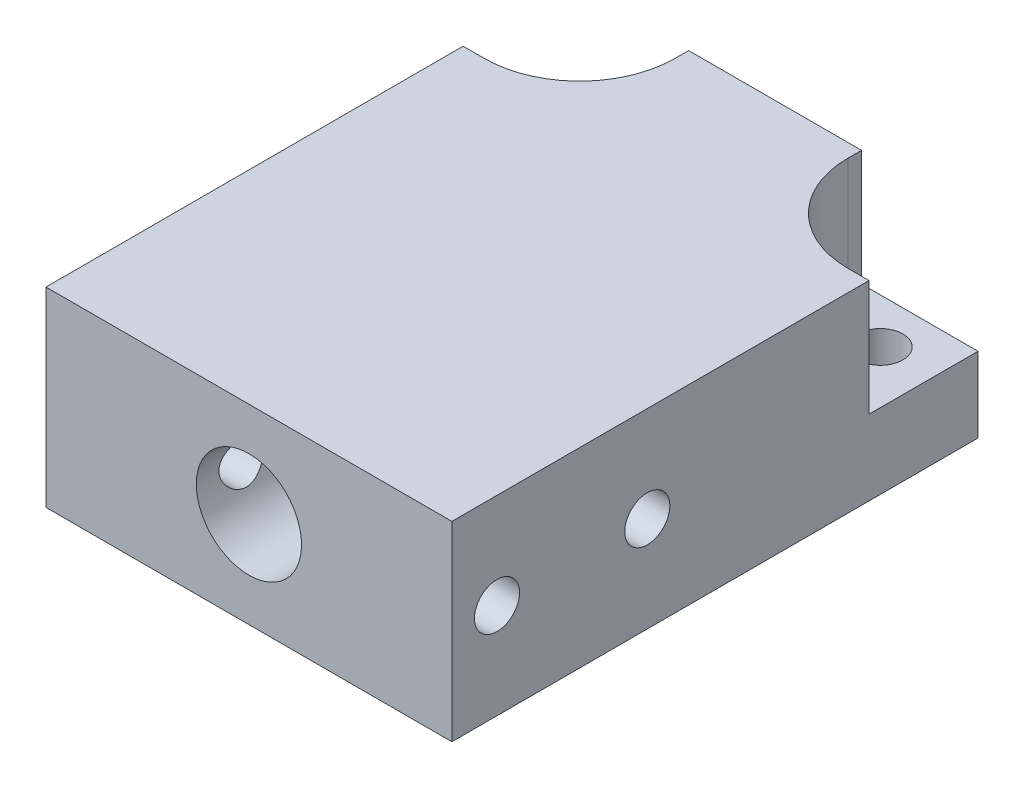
SolidWorks part; units mm, degrees
ref_plane "Front Plane" through (0, 0, 0) normal (0, 0, 1) x (1, 0, 0)
ref_plane "Top Plane" through (0, 0, 0) normal (0, 1, 0) x (1, 0, 0)
ref_plane "Right Plane" through (0, 0, 0) normal (1, 0, 0) x (0, 0, -1)
sketch "Sketch1" plane through (0, 0, 0) normal (0, 1, 0) x (1, 0, 0)
  line L1 (-13.5, -17.5) -> (13.5, -17.5)
  line L2 (-13.5, -17.5) -> (-13.5, 17.5)
  line L3 (-13.5, 17.5) -> (13.5, 17.5)
  line L4 (13.5, -17.5) -> (13.5, 17.5)
  line L5 (-13.5, -17.5) -> (13.5, 17.5) construction
  line L6 (-13.5, 17.5) -> (13.5, -17.5) construction
  point P0 (0, 0)
  dimension "D1" = 27
  dimension "D2" = 35
extrude "Boss-Extrude1" add sketch "Sketch1" along normal mid plane 12.7 contours L1 L4 L3 L2
sketch "Sketch2" plane through (0, 0, -17.5) normal (0, 0, -1) x (-1, 0, 0)
  circle A0 centre (0, 0) radius 3.5
  dimension "D1" = 7
extrude "Cut-Extrude1" cut sketch "Sketch2" against normal through all both and the other way through all
sketch "Sketch3" plane through (13.5, 0, 0) normal (1, 0, 0) x (0, 0, -1)
  line L0 (-17.5, 0) -> (-2.5, 0) construction
  line L1 (-17.5, 6.35) -> (-17.5, -6.35) construction
  line L2 (-4.5, 0) -> (-14.5, 0) construction
  circle A0 centre (-4.5, 0) radius 1.5
  circle A1 centre (-14.5, 0) radius 1.5
  dimension "D2" = 3
  dimension "D1" = 15
  dimension "D3" = 10
  dimension "D4" = 3
extrude "Cut-Extrude2" cut sketch "Sketch3" against normal through all both and the other way through all
sketch "Sketch4" plane through (0, 6.35, 0) normal (0, 1, 0) x (1, 0, 0)
  line L0 (-10, 14.5) -> (10, 14.5) construction
  line L1 (-13.5, 17.5) -> (13.5, 17.5) construction
  circle A0 centre (-10, 14.5) radius 1.5
  circle A1 centre (10, 14.5) radius 1.5
  point P2 (0, 14.5)
  dimension "D2" = 3
  dimension "D1" = 20
  dimension "D3" = 3
extrude "Cut-Extrude3" cut sketch "Sketch4" against normal through all both and the other way through all
sketch "Sketch9" plane through (0, 0, -17.5) normal (0, 0, -1) x (-1, 0, 0)
  point P0 (0, 0)
hole_wizard "Tap Drill for M10x1.0 Tap1" positions "3DSketch4" profile "Sketch10" hole size "M10x1.0" standard "ANSI Metric"
sketch3d "3DSketch4"
  point P0 (0, 0, -17.5)
  point P3 (0, 0, -17.5)
sketch "Sketch10" plane through (0, 0, -17.5) normal (1, 0, 0) x (0, 1, 0)
  line L0 (0, 0) -> (0, 8.7039)
  line L1 (0, 8.7039) -> (4.5, 6)
  line L2 (4.5, 6) -> (4.5, 0)
  line L5 (4.5, 0) -> (0, 0)
  line L10 (0, 8.7039) -> (-4.5, 6) construction
  line L11 (0, -6.35) -> (0, 107.95) construction
  dimension "Hole Dia." = 9
  dimension "Hole Depth" = 6
  dimension "Drill Angle" = 118
sketch "Sketch11" plane through (0, 6.35, 0) normal (0, 1, 0) x (1, 0, 0)
  line L0 (0, -6.985) -> (0, 6.985) construction
  line L1 (-13.5, 17.5) -> (-5.75, 17.5)
  line L2 (-13.5, 17.5) -> (-13.5, 10.25)
  line L3 (-13.5, 10.25) -> (-5.75, 10.25)
  line L4 (-5.75, 17.5) -> (-5.75, 10.25)
  line L5 (5.75, 17.5) -> (5.75, 10.25)
  line L6 (13.5, 17.5) -> (5.75, 17.5)
  line L7 (13.5, 17.5) -> (13.5, 10.25)
  line L8 (13.5, 10.25) -> (5.75, 10.25)
  circle A0 centre (-10, 14.5) radius 4.25 construction
  circle A1 centre (-10, 14.5) radius 1.5 construction
  dimension "D1" = 8.5
extrude "Cut-Extrude4" cut sketch "Sketch11" against normal offset from surface (7.7 mm away) 5
fillet "Fillet3" radius 6.35 2 edges at (5.75, 2.5, -10.25) (-5.75, 2.5, -10.25)
